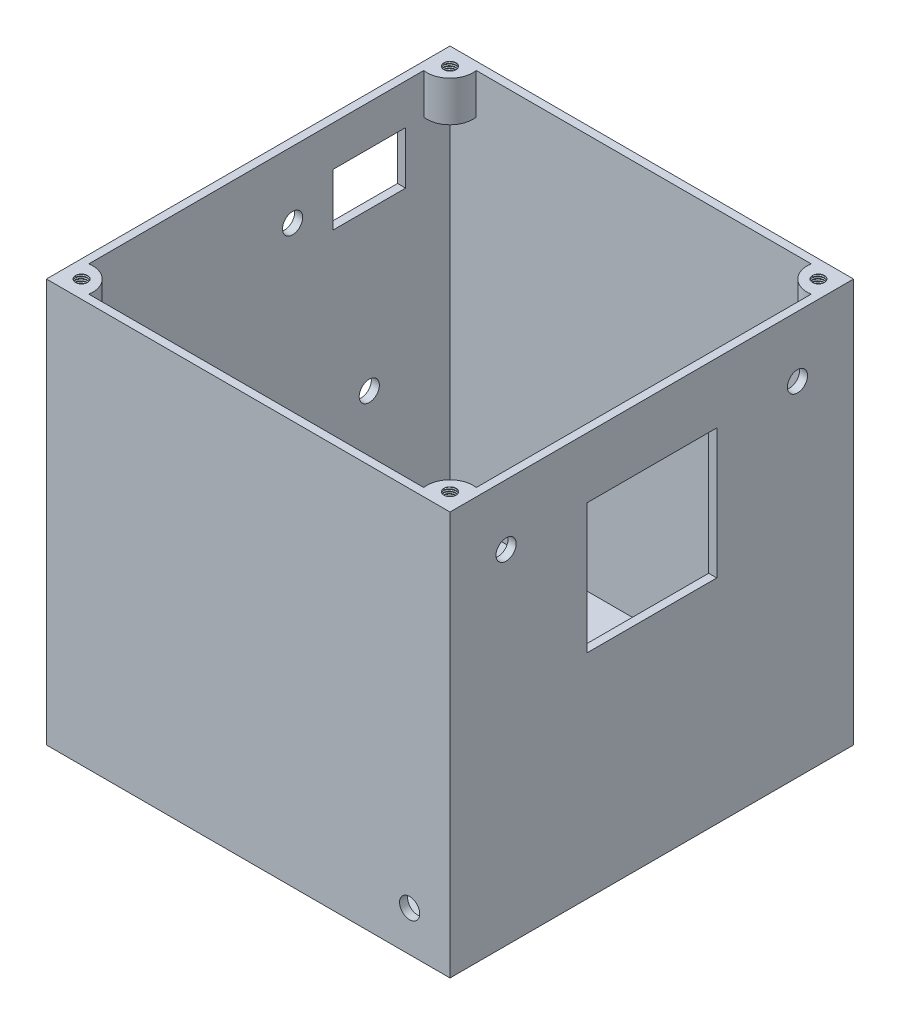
SolidWorks part; units mm, degrees
ref_plane "Front Plane" through (0, 0, 0) normal (0, 0, 1) x (1, 0, 0)
ref_plane "Top Plane" through (0, 0, 0) normal (0, 1, 0) x (1, 0, 0)
ref_plane "Right Plane" through (0, 0, 0) normal (1, 0, 0) x (0, 0, -1)
sketch "Esquisse1" plane through (0, 0, 0) normal (1, 0, 0) x (0, 0, -1)
  line L1 (-50, -50) -> (50, -50)
  line L2 (-50, -50) -> (-50, 50)
  line L3 (-50, 50) -> (50, 50)
  line L4 (50, -50) -> (50, 50)
  line L5 (-50, -50) -> (50, 50) construction
  line L6 (-50, 50) -> (50, -50) construction
  point P0 (0, 0)
  dimension "D1" = 100
  dimension "D2" = 100
extrude "Boss.-Extru.1" add sketch "Esquisse1" along normal blind 100
shell "Coque1" thickness 2
sketch "Esquisse2" plane through (0, 50, 0) normal (0, 1, 0) x (1, 0, 0)
  line L0 (100, 50) -> (0, 50) construction
  line L1 (0, 50) -> (0, -50) construction
  line L2 (98, 48) -> (2, 48) construction
  line L3 (2, 48) -> (2, -48) construction
  line L12 (98, 48) -> (2, 48) construction
  line L13 (2, -48) -> (2, 48) construction
  line L14 (8.5, 48) -> (2, 48)
  line L15 (2, 41.5) -> (2, 48)
  line L16 (50, 0) -> (32.4518, 0) construction
  line L17 (50, 0) -> (50, 19.4654) construction
  line L18 (2, -41.5) -> (2, -48)
  line L19 (8.5, -48) -> (2, -48)
  line L20 (91.5, -48) -> (98, -48)
  line L21 (98, -41.5) -> (98, -48)
  line L22 (98, 41.5) -> (98, 48)
  line L23 (91.5, 48) -> (98, 48)
  circle A0 centre (4.35, 45.65) radius 1.5
  arc A1 (8.5, 48) -> (2, 41.5) centre (2.9003, 47.0997) cw
  arc A2 (8.5, -48) -> (2, -41.5) centre (2.9003, -47.0997) ccw
  circle A3 centre (4.35, -45.65) radius 1.5
  circle A4 centre (95.65, -45.65) radius 1.5
  arc A5 (91.5, -48) -> (98, -41.5) centre (97.0997, -47.0997) cw
  arc A6 (91.5, 48) -> (98, 41.5) centre (97.0997, 47.0997) ccw
  circle A7 centre (95.65, 45.65) radius 1.5
  dimension "D1" = 3
  dimension "D2" = 4.35
  dimension "D3" = 4.35
  dimension "D4" = 6.5
  dimension "D5" = 6.5
extrude "Boss.-Extru.2" add sketch "Esquisse2" against normal blind 10
sketch "Esquisse3" plane through (100, 0, 0) normal (1, 0, 0) x (0, 0, -1)
  line L0 (50, 50) -> (-50, 50) construction
  line L1 (-16.1, 2.8) -> (16.1, 2.8)
  line L2 (-16.1, 2.8) -> (-16.1, 35)
  line L3 (-16.1, 35) -> (16.1, 35)
  line L4 (16.1, 2.8) -> (16.1, 35)
  line L5 (-16.1, 2.8) -> (16.1, 35) construction
  line L6 (-16.1, 35) -> (16.1, 2.8) construction
  point P0 (0, 18.9)
  dimension "D1" = 32.2
  dimension "D2" = 32.2
  dimension "D3" = 15
extrude "Enlèv. mat.-Extru.1" cut sketch "Esquisse3" against normal blind 8
sketch "Esquisse4" plane through (100, 0, 0) normal (1, 0, 0) x (0, 0, -1)
  line L0 (0, 0) -> (0, -21.1205) construction
  circle A0 centre (36.1, 35) radius 2.5
  circle A1 centre (-36.1, 35) radius 2.5
  dimension "D1" = 5
  dimension "D2" = 20
extrude "Enlèv. mat.-Extru.2" cut sketch "Esquisse4" against normal blind 8
sketch "Esquisse5" plane through (0, 0, 50) normal (0, 0, 1) x (1, 0, 0)
  line L0 (100, -50) -> (0, -50) construction
  line L1 (100, 50) -> (100, -50) construction
  circle A0 centre (90, -40) radius 2.5
  dimension "D1" = 5
  dimension "D2" = 10
  dimension "D3" = 10
extrude "Enlèv. mat.-Extru.3" cut sketch "Esquisse5" against normal blind 8
sketch "Esquisse6" plane through (0, 0, 0) normal (-1, 0, 0) x (0, 0, 1)
  line L0 (-50, -50) -> (-50, 50) construction
  line L1 (-37, 40) -> (-19, 40)
  line L2 (-37, 40) -> (-37, 27)
  line L3 (-37, 27) -> (-19, 27)
  line L4 (-19, 40) -> (-19, 27)
  line L5 (-50, 50) -> (50, 50) construction
  line L6 (50, -50) -> (-50, -50) construction
  line L7 (50, 50) -> (50, -50) construction
  circle A0 centre (-9, 33.5) radius 2.5
  circle A1 centre (-28, -12) radius 2.5
  circle A2 centre (30, -12) radius 2.5
  dimension "D5" = 5
  dimension "D7" = 5
  dimension "D9" = 5
  dimension "D1" = 18
  dimension "D2" = 13
  dimension "D3" = 13
  dimension "D4" = 10
  dimension "D6" = 10
  dimension "D8" = 38
  dimension "D10" = 38
  dimension "D11" = 20
extrude "Enlèv. mat.-Extru.4" cut sketch "Esquisse6" against normal blind 8
thread "Filetage1" pitch 0.5 start angle 0, offset 0, length 10, pitch 0.5, diameter 3
ref_plane "Plan1" through (2.85, 50, -45.65) normal (0, 0, 1) x (-1, 0, 0)
sketch "Profil de filetage1" plane through (2.85, 50, -45.65) normal (0, 0, 1) x (-1, 0, 0)
  line L0 (0, 0) -> (0, 0.5) construction
  line L1 (0, 0) -> (0.2706, 0.1562)
  line L2 (0.2706, 0.1562) -> (0.2706, 0.2187)
  line L3 (0.2706, 0.2187) -> (0, 0.375)
  line L4 (0.2706, 0.1875) -> (0, 0.1875) construction
  line L11 (0, 0) -> (0, 0.375)
  point P2 (0, 0)
  dimension "Pitch" = 0.5
  dimension "Profile_Angle" = 60
  dimension "Profile_Land" = 0.0625
  dimension "Profile_Height" = 0.2706
thread "Filetage2" pitch 0.5 start angle 0, offset 0, length 10, pitch 0.5, diameter 3
ref_plane "Plan2" through (94.15, 50, -45.65) normal (0, 0, 1) x (-1, 0, 0)
sketch "Profil de filetage2" plane through (94.15, 50, -45.65) normal (0, 0, 1) x (-1, 0, 0)
  line L0 (0, 0) -> (0, 0.5) construction
  line L1 (0, 0) -> (0.2706, 0.1562)
  line L2 (0.2706, 0.1562) -> (0.2706, 0.2187)
  line L3 (0.2706, 0.2187) -> (0, 0.375)
  line L4 (0.2706, 0.1875) -> (0, 0.1875) construction
  line L11 (0, 0) -> (0, 0.375)
  point P2 (0, 0)
  dimension "Pitch" = 0.5
  dimension "Profile_Angle" = 60
  dimension "Profile_Land" = 0.0625
  dimension "Profile_Height" = 0.2706
thread "Filetage3" pitch 0.5 start angle 0, offset 0, length 10, pitch 0.5, diameter 3
ref_plane "Plan3" through (2.85, 50, 45.65) normal (0, 0, 1) x (-1, 0, 0)
sketch "Profil de filetage3" plane through (2.85, 50, 45.65) normal (0, 0, 1) x (-1, 0, 0)
  line L0 (0, 0) -> (0, 0.5) construction
  line L1 (0, 0) -> (0.2706, 0.1562)
  line L2 (0.2706, 0.1562) -> (0.2706, 0.2187)
  line L3 (0.2706, 0.2187) -> (0, 0.375)
  line L4 (0.2706, 0.1875) -> (0, 0.1875) construction
  line L11 (0, 0) -> (0, 0.375)
  point P2 (0, 0)
  dimension "Pitch" = 0.5
  dimension "Profile_Angle" = 60
  dimension "Profile_Land" = 0.0625
  dimension "Profile_Height" = 0.2706
thread "Filetage4" pitch 0.5 start angle 0, offset 0, length 10, pitch 0.5, diameter 3
ref_plane "Plan4" through (94.15, 50, 45.65) normal (0, 0, 1) x (-1, 0, 0)
sketch "Profil de filetage4" plane through (94.15, 50, 45.65) normal (0, 0, 1) x (-1, 0, 0)
  line L0 (0, 0) -> (0, 0.5) construction
  line L1 (0, 0) -> (0.2706, 0.1562)
  line L2 (0.2706, 0.1562) -> (0.2706, 0.2187)
  line L3 (0.2706, 0.2187) -> (0, 0.375)
  line L4 (0.2706, 0.1875) -> (0, 0.1875) construction
  line L11 (0, 0) -> (0, 0.375)
  point P2 (0, 0)
  dimension "Pitch" = 0.5
  dimension "Profile_Angle" = 60
  dimension "Profile_Land" = 0.0625
  dimension "Profile_Height" = 0.2706
